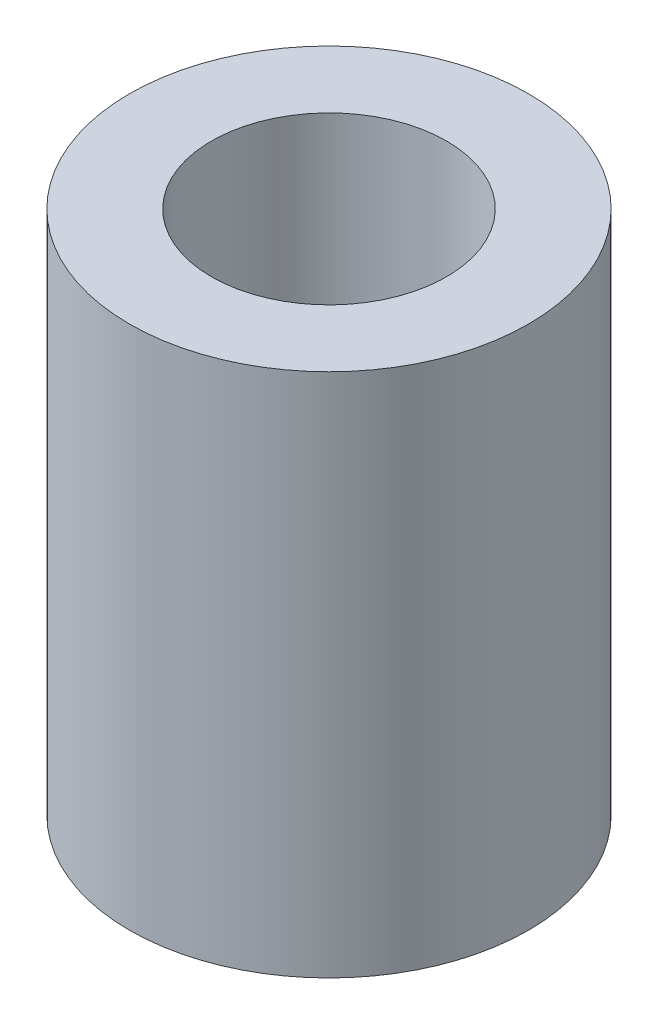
SolidWorks part; units mm, degrees
ref_plane "Front Plane" through (0, 0, 0) normal (0, 0, 1) x (1, 0, 0)
ref_plane "Top Plane" through (0, 0, 0) normal (0, 1, 0) x (1, 0, 0)
ref_plane "Right Plane" through (0, 0, 0) normal (1, 0, 0) x (0, 0, -1)
sketch "Sketch1" plane through (0, 0, 0) normal (0, 1, 0) x (1, 0, 0)
  circle A0 centre (0, 0) radius 2.413
  dimension "D1" = 4.826
extrude "Extrude1" add sketch "Sketch1" along normal blind 6.35
hole_wizard "#4-40 Tapped Hole1" positions "3DSketch1" profile "Sketch3" tap size "#4-40" standard "Ansi Inch"
sketch3d "3DSketch1"
  line L0 (0, 6.35, 0) -> (0, 0, 0) construction
  point P0 (0, 6.35, 0)
sketch "Sketch3" plane through (0, 6.35, 0) normal (1, 0, 0) x (0, 0, 1)
  line L0 (0, 0) -> (0, 6.35)
  line L1 (0, 6.35) -> (1.4224, 6.35)
  line L2 (1.4224, 6.35) -> (1.4224, 0)
  line L5 (1.4224, 0) -> (0, 0)
  line L11 (0, -6.35) -> (0, 107.95) construction
  dimension "Thread Major Dia." = 2.8448
  dimension "Thru Tap Drill Depth" = 6.35
